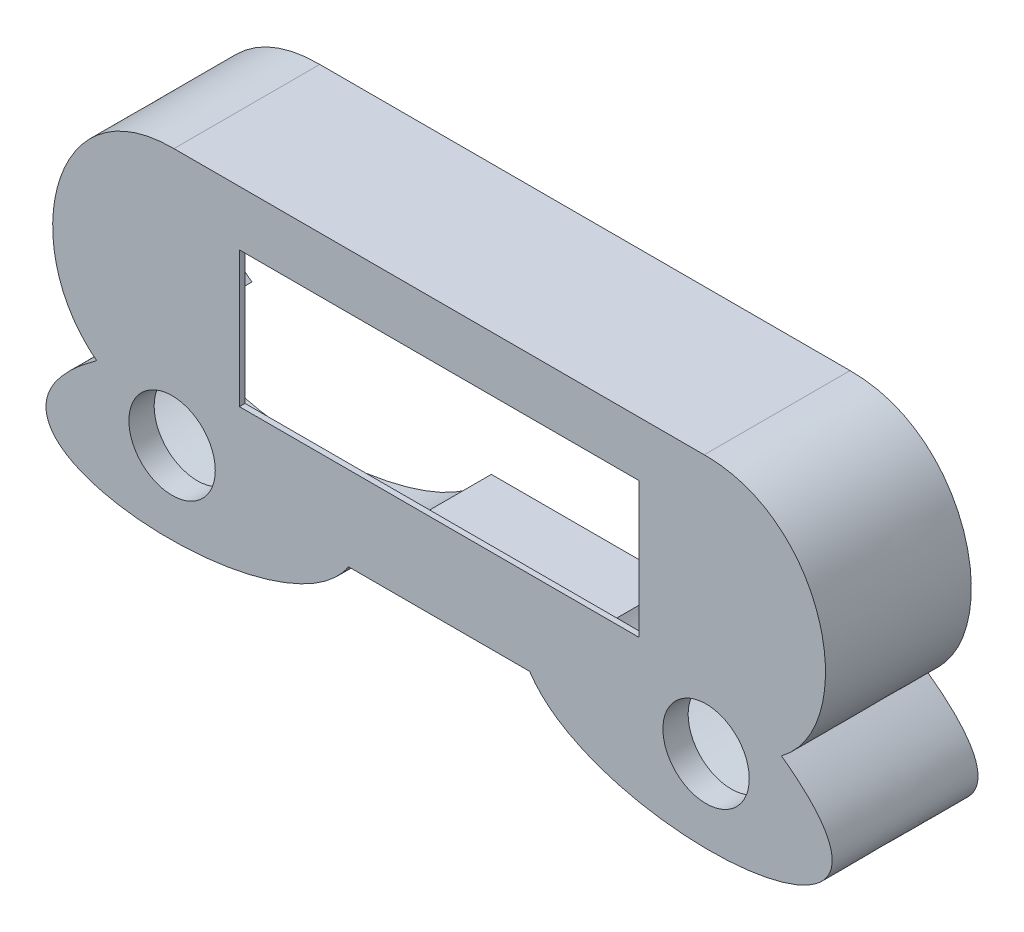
SolidWorks part; units mm, degrees
ref_plane "Plan de face" through (0, 0, 0) normal (0, 0, 1) x (1, 0, 0)
ref_plane "Plan de dessus" through (0, 0, 0) normal (0, 1, 0) x (1, 0, 0)
ref_plane "Plan de droite" through (0, 0, 0) normal (1, 0, 0) x (0, 0, -1)
sketch "Esquisse1" plane through (0, 0, 0) normal (0, 0, 1) x (1, 0, 0)
  line L0 (70, 60) -> (70, 0) construction
  line L1 (0, 0) -> (140, 0) construction
  line L2 (0, 0) -> (0, 60) construction
  line L3 (0, 60) -> (140, 60) construction
  line L4 (140, 0) -> (140, 60) construction
  line L5 (35, 60) -> (35, 0) construction
  line L6 (53.8609, 11) -> (86.1391, 11)
  line L7 (105, 60) -> (105, 0) construction
  line L9 (140, 30) -> (0, 30) construction
  line L10 (22.7291, 60) -> (117.2709, 60)
  line L11 (53.3188, 12) -> (86.6812, 12)
  line L12 (22.7251, 59) -> (117.2749, 59)
  spline S0 degree 3 poles (131.0403, 20.3886) (163.6476, -3.0027) (98.4939, -7.9737) (86.1391, 11) knots 0 0 0 0 1 1 1 1
  spline S1 degree 3 poles (8.9597, 20.3886) (-23.6476, -3.0027) (41.5061, -7.9737) (53.8609, 11) knots 0 0 0 0 1 1 1 1
  spline S2 degree 3 poles (22.7291, 60) (0.866, 60.1748) (-5.6767, 31.4647) (8.9597, 20.3886) knots 0 0 0 0 1 1 1 1
  spline S3 degree 3 poles (117.2709, 60) (139.134, 60.1748) (145.6767, 31.4647) (131.0403, 20.3886) knots 0 0 0 0 1 1 1 1
  spline S4 degree 1 poles (22.7251, 59) (10.6453, 20.3671) knots 0 0 1 1 construction
  spline S5 degree 1 poles (10.6453, 20.3671) (53.3188, 12) knots 0 0 1 1 construction
  spline S6 degree 1 poles (129.3547, 20.3671) (86.6812, 12) knots 0 0 1 1 construction
  spline S7 degree 1 poles (117.2749, 59) (129.3547, 20.3671) knots 0 0 1 1 construction
  spline S8 degree 3 poles (22.7251, 59) (22.0689, 59.0052) (20.734, 58.9597) (18.2521, 58.6533) (15.3725, 57.8929) (12.3092, 56.4477) (8.7323, 53.8993) (5.2284, 49.7073) (2.6553, 43.6034) (1.8131, 37.0074) (2.6137, 31.6005) (4.1805, 27.6199) (5.8191, 24.878) (7.5919, 22.8406) (9.0224, 21.5906) (9.9388, 20.9027) (10.411, 20.5444) (10.6453, 20.3671) knots -0.000061 -0.000061 -0.000061 -0.000061 0.031961 0.063983 0.128027 0.192071 0.256116 0.384204 0.512292 0.64038 0.768469 0.832513 0.896557 0.960601 0.992623 1.008634 1.024645 1.024645 1.024645 1.024645
  spline S9 degree 3 poles (10.6453, 20.3671) (10.1303, 19.9976) (9.0711, 19.2467) (7.6665, 18.1791) (6.3994, 17.1362) (4.9039, 15.7925) (3.3824, 14.1976) (2.0849, 12.4341) (1.2763, 10.8376) (0.7853, 8.9494) (1.0652, 7.0153) (2.6579, 4.9145) (5.5856, 3.079) (9.6032, 1.6687) (16.0661, 0.4209) (25.5807, 0.1166) (35.3821, 1.5659) (42.4297, 3.7949) (47.0736, 5.9946) (50.2122, 8.2584) (51.9197, 10.0418) (52.6543, 10.9964) (53.0188, 11.536) (53.2204, 11.8489) (53.3188, 12) knots -0.011273 -0.011273 -0.011273 -0.011273 0.004653 0.020579 0.036505 0.052431 0.084283 0.116134 0.147986 0.179838 0.243541 0.307244 0.370948 0.434651 0.498355 0.625761 0.753168 0.816872 0.880575 0.944278 0.97613 0.992056 1.000019 1.007982 1.007982 1.007982 1.007982
  spline S10 degree 3 poles (86.6812, 12) (86.7796, 11.8489) (86.9812, 11.536) (87.3457, 10.9964) (88.0803, 10.0418) (89.7878, 8.2584) (92.9264, 5.9946) (97.5703, 3.7949) (104.6179, 1.5659) (114.4193, 0.1166) (123.9339, 0.4209) (130.3968, 1.6687) (134.4144, 3.079) (137.3421, 4.9145) (138.9348, 7.0153) (139.2147, 8.9494) (138.7237, 10.8376) (137.9151, 12.4341) (136.6176, 14.1976) (135.0961, 15.7925) (133.6006, 17.1362) (132.3335, 18.1791) (130.9289, 19.2467) (129.8697, 19.9976) (129.3547, 20.3671) knots -0.011273 -0.011273 -0.011273 -0.011273 -0.00331 0.004653 0.020579 0.052431 0.116134 0.179838 0.243541 0.370948 0.498355 0.562058 0.625761 0.689465 0.753168 0.816872 0.848723 0.880575 0.912427 0.944278 0.960204 0.97613 0.992056 1.007982 1.007982 1.007982 1.007982
  spline S11 degree 3 poles (129.3547, 20.3671) (129.589, 20.5444) (130.0612, 20.9027) (130.9776, 21.5906) (132.4081, 22.8406) (134.1809, 24.878) (135.8195, 27.6199) (137.3863, 31.6005) (138.1869, 37.0074) (137.3447, 43.6034) (134.7716, 49.7073) (131.2677, 53.8993) (127.6908, 56.4477) (124.6275, 57.8929) (121.7479, 58.6533) (119.266, 58.9597) (117.9311, 59.0052) (117.2749, 59) knots -0.000061 -0.000061 -0.000061 -0.000061 0.01595 0.031961 0.063983 0.128027 0.192071 0.256116 0.384204 0.512292 0.64038 0.768469 0.832513 0.896557 0.960601 0.992623 1.024645 1.024645 1.024645 1.024645
  point P16 (70, 11)
  dimension "D1" = 140
  dimension "D2" = 60
  dimension "D3" = 35
  dimension "D4" = 35
  dimension "D6" = 49
  dimension "D5" = 1
extrude "Boss.-Extru.2" add sketch "Esquisse1" along normal blind 25 contours S3 L10 S2 S1 L6 S0 S11 S10 L11 S9 S8 L12
sketch "Esquisse2" plane through (0, 0, 25) normal (0, 0, 1) x (1, 0, 0)
  line L2 (117.2709, 60) -> (22.7291, 60)
  line L3 (53.8609, 11) -> (86.1391, 11)
  line L4 (117.2709, 60) -> (22.7291, 60)
  line L5 (53.8609, 11) -> (86.1391, 11)
  spline S4 degree 3 poles (-1115.5527, 2732.3735) (829.9361, -3010.0671) (49.9817, 3167.1128) (-415.0526, -2877.6882) knots -3.58865 -3.58865 -3.58865 -3.58865 4.447442 4.447442 4.447442 4.447442 only from (131.0403, 20.3886) to (117.2709, 60)
  spline S5 degree 3 poles (555.0566, -2877.7402) (90.0235, 3167.1387) (-689.9392, -3010.0639) (1255.5435, 2732.3461) knots -3.447466 -3.447466 -3.447466 -3.447466 4.588637 4.588637 4.588637 4.588637 only from (22.7291, 60) to (8.9597, 20.3886)
  spline S6 degree 3 poles (2985.9289, 366.0401) (-3253.5791, -58.4193) (3288.1791, -278.4321) (-2873.0118, 641.0452) knots -2.125004 -2.125004 -2.125004 -2.125004 3.406637 3.406637 3.406637 3.406637 only from (8.9597, 20.3886) to (53.8609, 11)
  spline S7 degree 3 poles (3012.9934, 641.0424) (-3148.1388, -278.4276) (3393.5149, -58.4208) (-2845.846, 366.0344) knots -2.406632 -2.406632 -2.406632 -2.406632 3.12498 3.12498 3.12498 3.12498 only from (86.1391, 11) to (131.0403, 20.3886)
  spline S8 degree 3 poles (131.0403, 20.3886) (145.6767, 31.4647) (139.134, 60.1748) (117.2709, 60) knots 0 0 0 0 1 1 1 1
  spline S9 degree 3 poles (22.7291, 60) (0.866, 60.1748) (-5.6767, 31.4647) (8.9597, 20.3886) knots 0 0 0 0 1 1 1 1
  spline S10 degree 3 poles (8.9597, 20.3886) (-23.6476, -3.0027) (41.5061, -7.9737) (53.8609, 11) knots 0 0 0 0 1 1 1 1
  spline S11 degree 3 poles (86.1391, 11) (98.4939, -7.9737) (163.6476, -3.0027) (131.0403, 20.3886) knots 0 0 0 0 1 1 1 1
  dimension "D1" = 0
extrude "Boss.-Extru.3" add sketch "Esquisse2" along normal blind 1
sketch "Esquisse3" plane through (0, 0, 26) normal (0, 0, 1) x (1, 0, 0)
  line L0 (53.8609, 11) -> (86.1391, 11) construction
  line L1 (34.4, 50.2) -> (105.6, 50.2)
  line L2 (34.4, 50.2) -> (34.4, 26)
  line L3 (34.4, 26) -> (105.6, 26)
  line L4 (105.6, 50.2) -> (105.6, 26)
  line L6 (117.2709, 60) -> (22.7291, 60) construction
  circle A0 centre (22.4, 14) radius 7.7
  circle A1 centre (117.6, 14) radius 7.7
  point P11 (70, 60)
  dimension "D3" = 15.4
  dimension "D4" = 15.4
  dimension "D5" = 12
  dimension "D1" = 71.2
  dimension "D2" = 24.2
  dimension "D6" = 12
  dimension "D7" = 15
  dimension "D8" = 35.6
  dimension "D9" = 12
  dimension "D10" = 12
extrude "Enlèv. mat.-Extru.1" cut sketch "Esquisse3" against normal blind 10
sketch "Esquisse4" plane through (0, 0, 25) normal (0, 0, -1) x (-1, 0, 0)
  circle A0 centre (-117.6, 14) radius 7.7
  circle A1 centre (-22.4, 14) radius 7.7
  circle A2 centre (-117.6, 14) radius 8.7
  circle A3 centre (-22.4, 14) radius 8.7
  dimension "D1" = 15.4
  dimension "D2" = 15.4
  dimension "D3" = 1
extrude "Boss.-Extru.4" add sketch "Esquisse4" along normal blind 3.5
